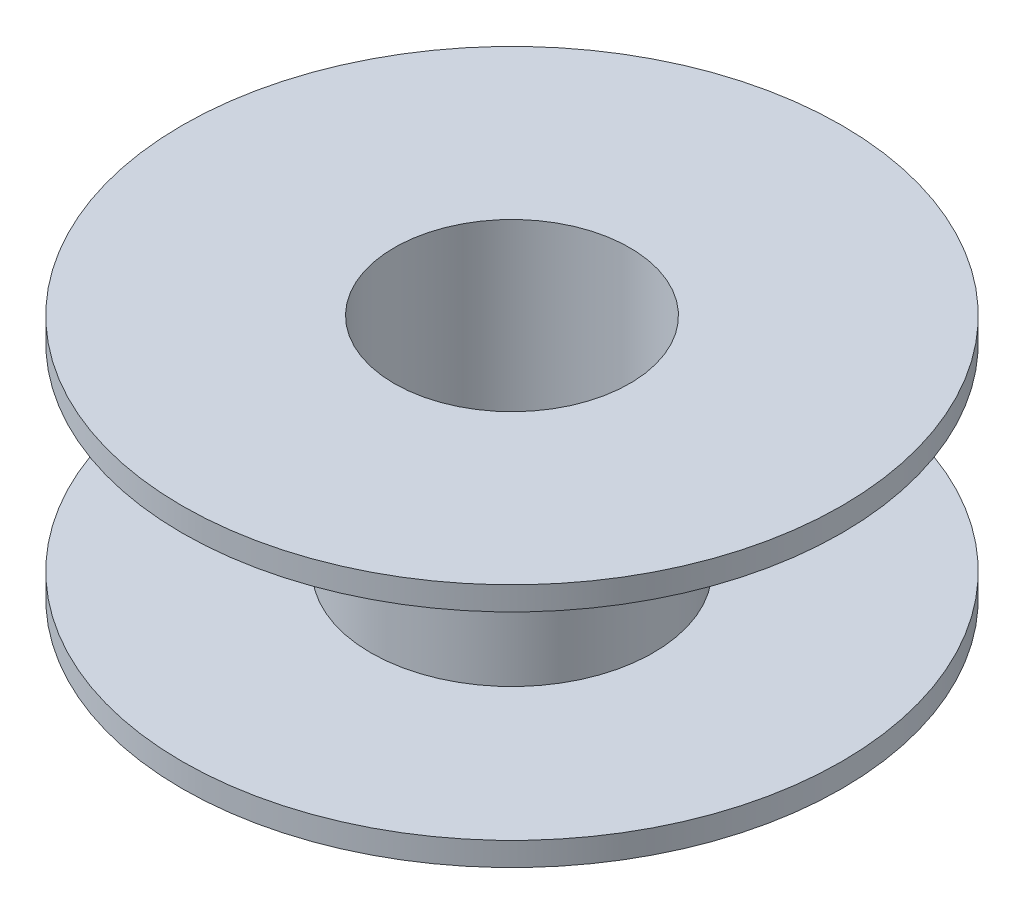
SolidWorks part; units mm, degrees
other "標示1"
sketch "草圖2" plane through (7, -2.6, 7) normal (0.1821, -0.9243, 0.3353) x (0.9763, 0.1296, -0.1731)
ref_plane "前基準面" through (0, 0, 0) normal (0, 0, 1) x (1, 0, 0)
ref_plane "上基準面" through (0, 0, 0) normal (0, 1, 0) x (1, 0, 0)
ref_plane "右基準面" through (0, 0, 0) normal (1, 0, 0) x (0, 0, -1)
sketch "草圖1" plane through (0, 0, 0) normal (0, 0, 1) x (1, 0, 0)
  line L0 (0, 3.5455) -> (0, -3.9204) construction
  line L1 (-2.5, 2.6) -> (-7, 2.6)
  line L2 (-7, 2.6) -> (-7, 2.1)
  line L3 (-7, -2.6) -> (-2.5, -2.6)
  line L5 (-7, 2.1) -> (-3, 2.1)
  line L6 (-3, 2.1) -> (-3, -2.1)
  line L7 (-3, -2.1) -> (-7, -2.1)
  line L8 (-7, -2.1) -> (-7, -2.6)
  line L9 (-2.5, 2.6) -> (0, 2.6) construction
  line L10 (-2.5, 2.6) -> (-2.5, -2.6)
  line L11 (-2.5, -2.6) -> (0, -2.6) construction
  point P15 (-2.5, 0)
  dimension "D1" = 5.2
  dimension "D2" = 7
  dimension "D3" = 2.5
  dimension "D4" = 0.5
  dimension "D5" = 0.5
  dimension "D6" = 0.5
revolve "旋轉1" add sketch "草圖1" angle 360 about L0
